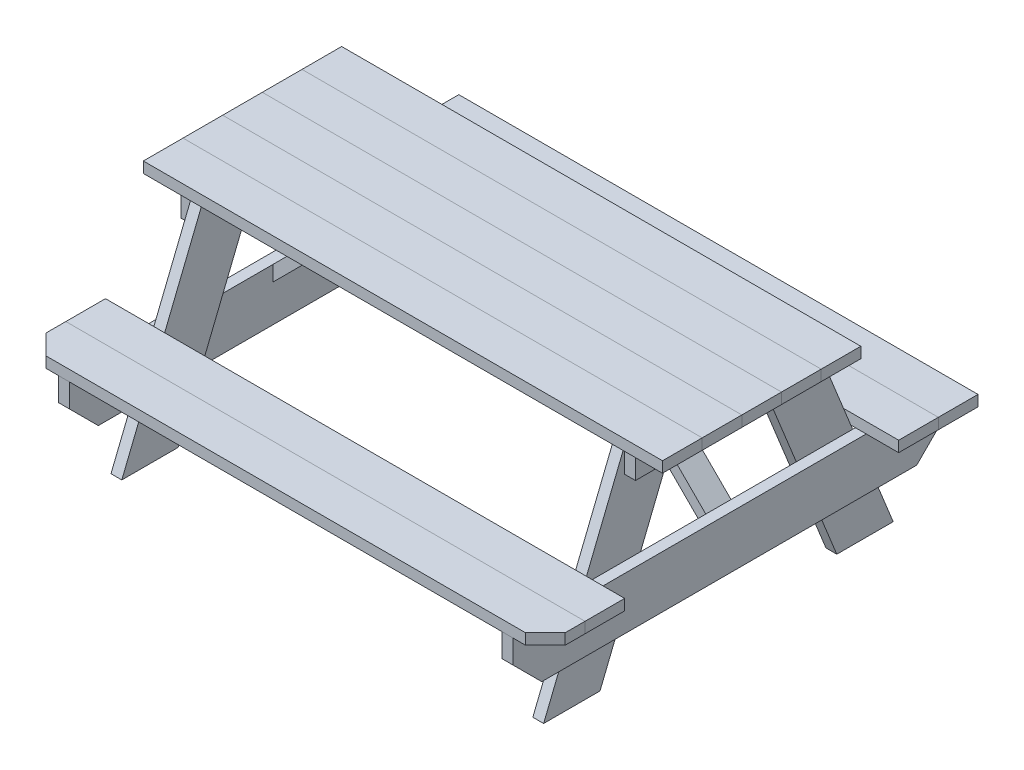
SolidWorks part; units mm, degrees
ref_plane "Front Plane" through (0, 0, 0) normal (0, 0, 1) x (1, 0, 0)
ref_plane "Top Plane" through (0, 0, 0) normal (0, 1, 0) x (1, 0, 0)
ref_plane "Right Plane" through (0, 0, 0) normal (1, 0, 0) x (0, 0, -1)
ref_plane "A-Frame Plane" through (-762, 0, 0) normal (1, 0, 0) x (0, 0, -1)
sketch "A-Frame Layout" plane through (-762, 0, 0) normal (1, 0, 0) x (0, 0, -1)
  line L0 (0, 0) -> (0, 706.5141) construction
  line L1 (330.2, 706.5141) -> (-330.2, 706.5141)
  line L2 (-330.2, 706.5141) -> (-615.6502, 0)
  line L3 (-762, 353.257) -> (762, 353.257)
  line L4 (330.2, 706.5141) -> (615.6502, 0)
  line L5 (-615.6502, 0) -> (0, 0) construction
  point P8 (0, 353.257)
  point P10 (-472.9251, 353.257)
  dimension "D1" = 762
  dimension "D2" = 660.4
  dimension "D3" = 68
  dimension "D4" = 1524
sketch "Top and Brace Layout" plane through (0, 0, 0) normal (0, 0, 1) x (1, 0, 0)
  line L0 (0, 0) -> (0, 706.5141) construction
  line L1 (-914.4, 706.5141) -> (914.4, 706.5141)
  line L3 (-762, 353.257) -> (-408.743, 706.5141)
  line L4 (-762, 0) -> (-762, 706.5141) construction
  dimension "D1" = 1828.8
  dimension "D2" = 45
other "Softwood 2 X 8(1)"
ref_plane "Plane1" through (-762, 706.5141, 330.2) normal (0, -0.9272, 0.3746) x (1, 0, 0)
sketch "Sketch1" plane through (-762, 706.5141, 330.2) normal (0, -0.9272, 0.3746) x (1, 0, 0)
  line L1 (-19.05, -92.075) -> (19.05, -92.075)
  line L2 (-19.05, -92.075) -> (-19.05, 92.075)
  line L3 (-19.05, 92.075) -> (19.05, 92.075)
  line L4 (19.05, -92.075) -> (19.05, 92.075)
  line L5 (0, 92.075) -> (0, -92.075) construction
  line L6 (-19.05, 0) -> (19.05, 0) construction
  point P0 (0, 0)
  point P4 (0, 0)
  dimension "Thickness" = 38.1
  dimension "Width" = 184.15
other "Softwood 2 X 4(1)"
ref_plane "Plane2" through (-762, 706.5141, -330.2) normal (0, 0, 1) x (1, 0, 0)
sketch "Sketch11" plane through (-762, 706.5141, -330.2) normal (0, 0, 1) x (1, 0, 0)
  line L1 (-19.05, -44.45) -> (19.05, -44.45)
  line L2 (-19.05, -44.45) -> (-19.05, 44.45)
  line L3 (-19.05, 44.45) -> (19.05, 44.45)
  line L4 (19.05, -44.45) -> (19.05, 44.45)
  line L5 (0, 44.45) -> (0, -44.45) construction
  line L6 (-19.05, 0) -> (19.05, 0) construction
  point P0 (0, 0)
  point P4 (0, 0)
  dimension "Thickness" = 38.1
  dimension "Width" = 88.9
other "Softwood 2 X 6(1)"
ref_plane "Plane3" through (-914.4, 725.5641, 0) normal (1, 0, 0) x (0, 1, 0)
sketch "Sketch12" plane through (-914.4, 725.5641, 0) normal (1, 0, 0) x (0, 1, 0)
  line L1 (-19.05, -69.85) -> (19.05, -69.85)
  line L2 (-19.05, -69.85) -> (-19.05, 69.85)
  line L3 (-19.05, 69.85) -> (19.05, 69.85)
  line L4 (19.05, -69.85) -> (19.05, 69.85)
  line L5 (0, 69.85) -> (0, -69.85) construction
  line L6 (-19.05, 0) -> (19.05, 0) construction
  point P0 (0, 0)
  point P4 (0, 0)
  dimension "Thickness" = 38.1
  dimension "Width" = 139.7
other "Trim/Extend1"
other "Trim/Extend2"
mirror "Mirror1" about plane through (0, 0, 0) normal (1, 0, 0)
pattern_linear "LPattern1" count 3 spacing 139.7 along (0, 0, -1) count 3 spacing 139.7 along (0, 0, 1)
sketch "Sketch13" plane through (0, 353.257, 0) normal (0, 1, 0) x (1, 0, 0)
  line L0 (-800.1, -762) -> (800.1, -762) construction
  line L1 (-914.4, -762) -> (914.4, -762)
  line L2 (0, 0) -> (0, -1051.8517) construction
  dimension "D1" = 1828.8
other "Softwood 2 X 6(2)"
ref_plane "Plane4" through (-914.4, 372.307, 692.15) normal (1, 0, 0) x (0, 1, 0)
sketch "Sketch14" plane through (-914.4, 372.307, 692.15) normal (1, 0, 0) x (0, 1, 0)
  line L1 (-19.05, -69.85) -> (19.05, -69.85)
  line L2 (-19.05, -69.85) -> (-19.05, 69.85)
  line L3 (-19.05, 69.85) -> (19.05, 69.85)
  line L4 (19.05, -69.85) -> (19.05, 69.85)
  line L5 (0, 69.85) -> (0, -69.85) construction
  line L6 (-19.05, 0) -> (19.05, 0) construction
  point P0 (0, 0)
  point P4 (0, 0)
  dimension "Thickness" = 38.1
  dimension "Width" = 139.7
mirror "Mirror2" about plane through (914.4, 353.257, 622.3) normal (0, 0, 1)
mirror "Mirror3" about plane through (0, 0, 0) normal (0, 0, 1)
chamfer "Chamfer1" distance 69.85 angle 45 2 edges at (-914.4, 372.307, 762) (914.4, 372.307, 762)
chamfer "Chamfer2" distance 101.6 angle 45 2 edges at (781.05, 169.107, 762) (781.05, 169.107, -762)
chamfer "Chamfer3" distance 101.6 angle 45 2 edges at (-781.05, 169.107, 762) (-781.05, 169.107, -762)
